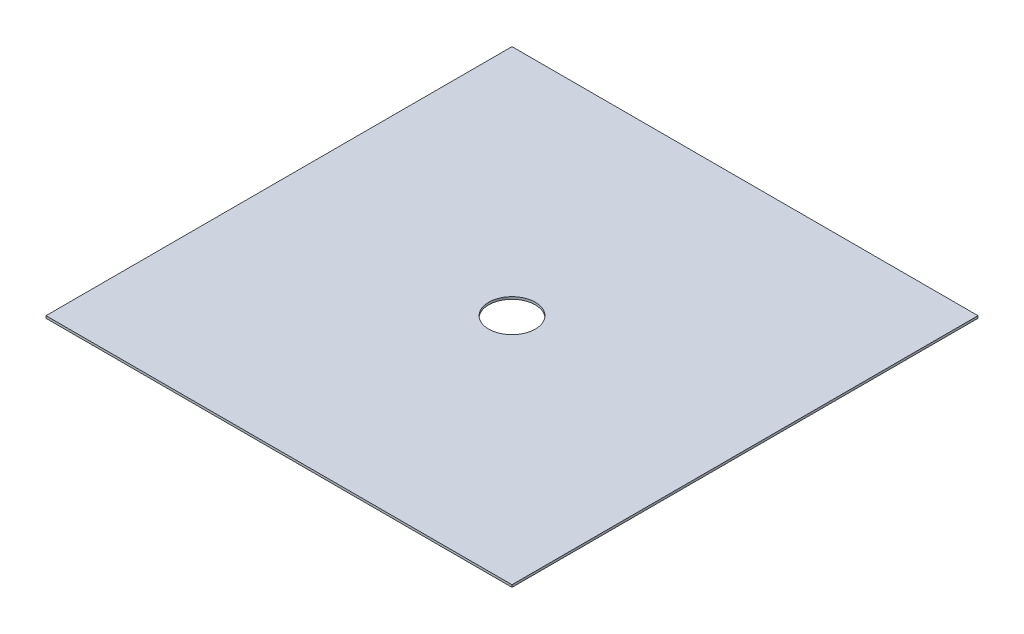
SolidWorks part; units mm, degrees
ref_plane "Front Plane" through (0, 0, 0) normal (0, 0, 1) x (1, 0, 0)
ref_plane "Top Plane" through (0, 0, 0) normal (0, 1, 0) x (1, 0, 0)
ref_plane "Right Plane" through (0, 0, 0) normal (1, 0, 0) x (0, 0, -1)
body saved out of another part "Stock-Sarrus Mechanism-1"
sketch "Sketch2" plane through (0, 2.667, 0) normal (0, 1, 0) x (1, 0, 0)
  line L0 (114.3, 25.4) -> (114.3, -25.4) construction
  line L3 (139.7, 25.4) -> (88.9, 25.4) construction
  line L6 (88.9, -25.4) -> (139.7, -25.4) construction
  line L7 (88.9, 0) -> (139.7, 0) construction
  line L8 (88.9, -25.4) -> (88.9, 25.4) construction
  line L9 (139.7, -25.4) -> (139.7, 25.4) construction
  circle A0 centre (114.3, 0) radius 2.54
  point P14 (114.3, 0)
  dimension "D3" = 5.08
extrude "Cut-Extrude1" cut sketch "Sketch2" against normal through all
